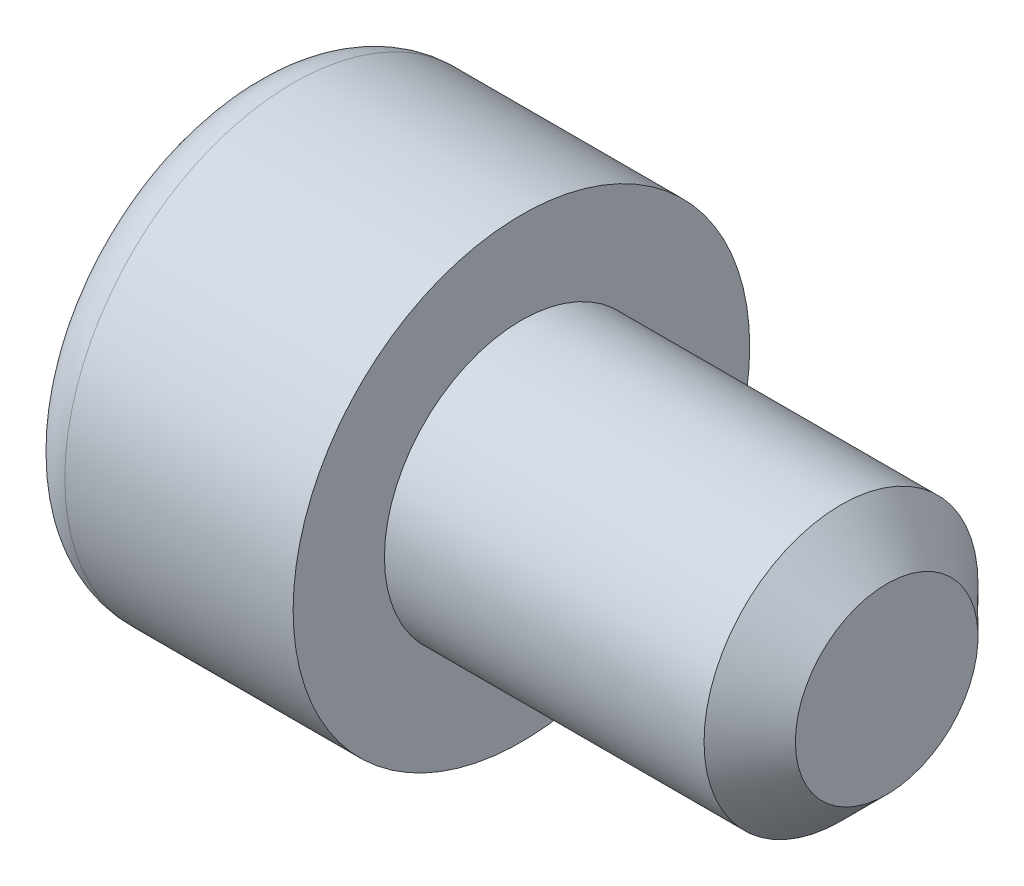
SolidWorks part; units mm, degrees
ref_plane "Plan1" through (0, 0, 0) normal (0, 0, 1) x (1, 0, 0)
ref_plane "Plan2" through (0, 0, 0) normal (0, 1, 0) x (1, 0, 0)
ref_plane "Plan3" through (0, 0, 0) normal (1, 0, 0) x (0, 0, -1)
sketch "Esquisse1" plane through (0, 0, 0) normal (0, 0, 1) x (1, 0, 0)
  line L0 (-28.5762, 0) -> (8, 0) construction
  line L1 (-6, 0) -> (-6, 4)
  line L3 (-5, 5) -> (0, 5)
  line L4 (0, 5) -> (0, 3)
  line L5 (0, 3) -> (7, 3)
  line L6 (7, 3) -> (8, 2)
  line L7 (8, 2) -> (8, 0)
  line L8 (8, 0) -> (-6, 0)
  arc A0 (-6, 4) -> (-5, 5) centre (-5, 4) cw
  dimension "D3" = 1
  dimension "D1" = 1
  dimension "D2" = 1
  dimension "D4" = 8
  dimension "D5" = 5
  dimension "D6" = 6
revolve "Base-Révolution" add sketch "Esquisse1" angle 360 about L0
sketch "Esquisse2" plane through (-6, 5.4655, -1.3914) normal (-1, 0, 0) x (0, 0, 1)
  line L4 (-0.5046, -7.6591) -> (-1.508, -5.4655)
  line L5 (2.8032, -7.998) -> (-0.5046, -7.6591)
  line L8 (4.2909, -5.4655) -> (2.8032, -7.998)
  line L9 (-1.508, -5.4655) -> (-0.0203, -2.9329)
  line L11 (-0.0203, -2.9329) -> (3.2874, -3.2718)
  line L13 (3.2874, -3.2718) -> (4.2909, -5.4655)
  dimension "D1" = 5
  dimension "D2" = 4.7509
  dimension "D3" = 5.2734
extrude "Enlèv. mat.-Extru.1" cut sketch "Esquisse2" against normal blind 3
